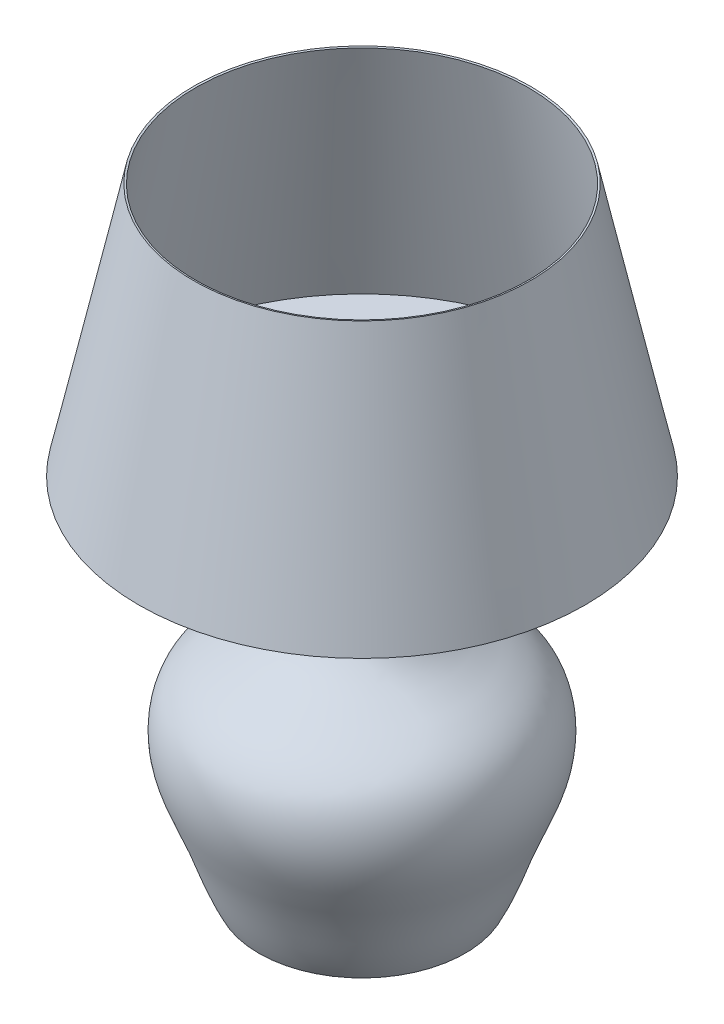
SolidWorks part; units mm, degrees
ref_plane "Płaszczyzna przednia" through (0, 0, 0) normal (0, 0, 1) x (1, 0, 0)
ref_plane "Płaszczyzna górna" through (0, 0, 0) normal (0, 1, 0) x (1, 0, 0)
ref_plane "Płaszczyzna prawa" through (0, 0, 0) normal (1, 0, 0) x (0, 0, -1)
sketch "Szkic1" plane through (0, 0, 0) normal (0, 0, 1) x (1, 0, 0)
  line L0 (584, 1168) -> (2920, 1168) construction
  line L1 (1739.7124, 581.2017) -> (1904.4707, 581.2017)
  line L2 (1847.9232, 1092.246) -> (1893.7752, 1092.246)
  line L3 (1893.7752, 1092.246) -> (1893.7752, 1158.1127)
  line L4 (1893.7752, 1158.1127) -> (1548.4673, 1158.1127)
  line L5 (1548.4673, 1158.1127) -> (1635.6405, 1562.8632)
  line L6 (1904.4707, 581.2017) -> (1904.4707, 1229.5149) construction
  spline S0 degree 3 poles (1739.7124, 581.2017) (1722.6255, 613.6669) (1702.2778, 686.5655) (1654.288, 779.0581) (1670.3186, 876.1669) (1735.3327, 919.99) (1809.6878, 954.3315) (1847.9044, 1026.9292) (1847.7121, 1077.0107) (1847.9232, 1092.246) knots 0 0 0 0 0.183345 0.378136 0.513085 0.628441 0.753013 0.921604 1 1 1 1
revolve "Obrót-cienka ścianka4" add sketch "Szkic1" angle 360 about L6
